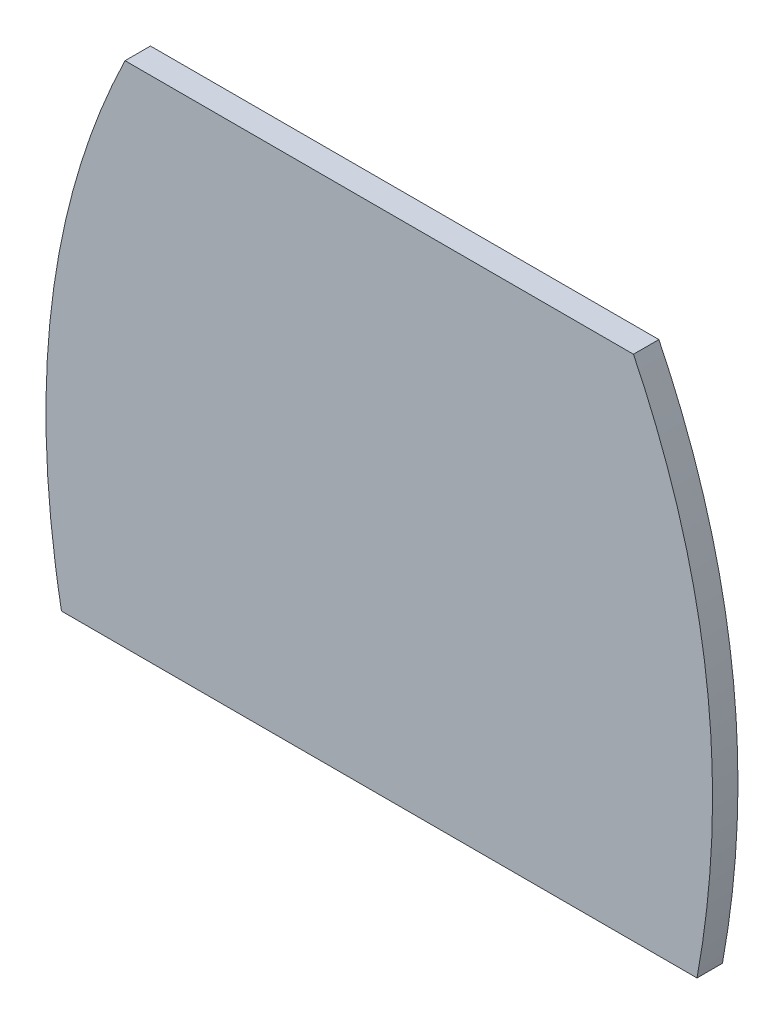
SolidWorks part; units mm, degrees
ref_plane "Front Plane" through (0, 0, 0) normal (0, 0, 1) x (1, 0, 0)
ref_plane "Top Plane" through (0, 0, 0) normal (0, 1, 0) x (1, 0, 0)
ref_plane "Right Plane" through (0, 0, 0) normal (1, 0, 0) x (0, 0, -1)
sketch "Sketch1" plane through (0, 0, 0) normal (0, 0, 1) x (1, 0, 0)
  line L0 (-19.2884, 0) -> (30.7116, 0)
  line L1 (-14.2884, 40) -> (25.7116, 40)
  spline S0 degree 2 poles (-19.2884, 0) (-23.2661, 21.537) (-14.2884, 40) knots 0 0 0 1 1 1
  spline S1 degree 2 poles (30.7116, 0) (34.6892, 21.537) (25.7116, 40) knots 0 0 0 1 1 1
  point P5 (-16.9914, 33.5637)
  dimension "D1" = 50
  dimension "D2" = 40
  dimension "D5" = 40
extrude "Boss-Extrude1" add sketch "Sketch1" along normal blind 2
